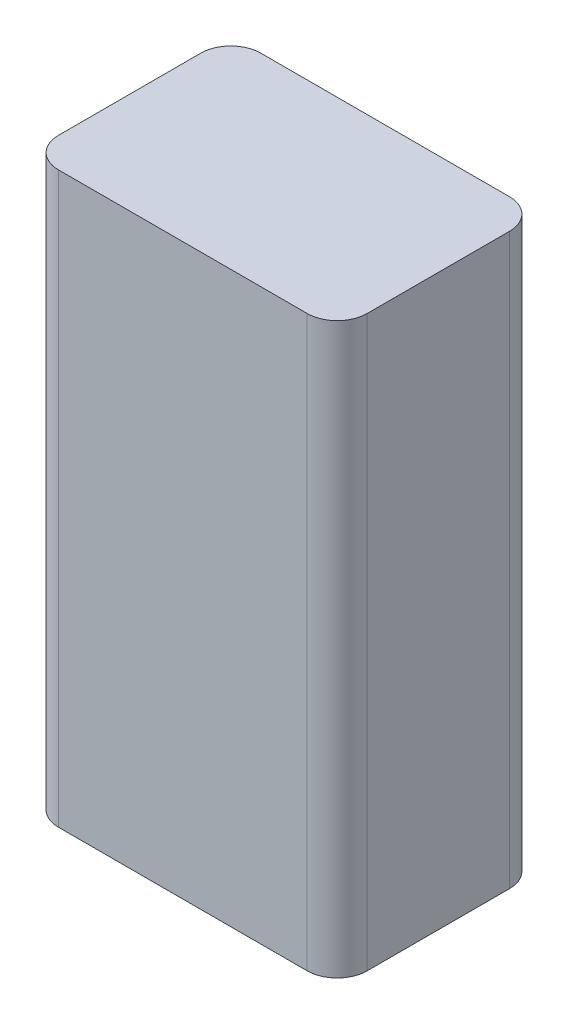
SolidWorks part; units mm, degrees
ref_plane "Front Plane" through (0, 0, 0) normal (0, 0, 1) x (1, 0, 0)
ref_plane "Top Plane" through (0, 0, 0) normal (0, 1, 0) x (1, 0, 0)
ref_plane "Right Plane" through (0, 0, 0) normal (1, 0, 0) x (0, 0, -1)
sketch "Sketch1" plane through (0, 0, 0) normal (0, 0, 1) x (1, 0, 0)
  line L1 (-13.081, -24.13) -> (13.081, -24.13)
  line L2 (-13.081, -24.13) -> (-13.081, 24.13)
  line L3 (-13.081, 24.13) -> (13.081, 24.13)
  line L4 (13.081, -24.13) -> (13.081, 24.13)
  line L5 (-13.081, -24.13) -> (13.081, 24.13) construction
  line L6 (-13.081, 24.13) -> (13.081, -24.13) construction
  point P0 (0, 0)
  dimension "D1" = 48.26
  dimension "D2" = 26.162
extrude "Boss-Extrude1" add sketch "Sketch1" along normal mid plane 17.145
fillet "Fillet1" radius 2.54 4 edges at (-13.081, 0, -8.5725) (13.081, 0, -8.5725) (13.081, 0, 8.5725) (-13.081, 0, 8.5725)
